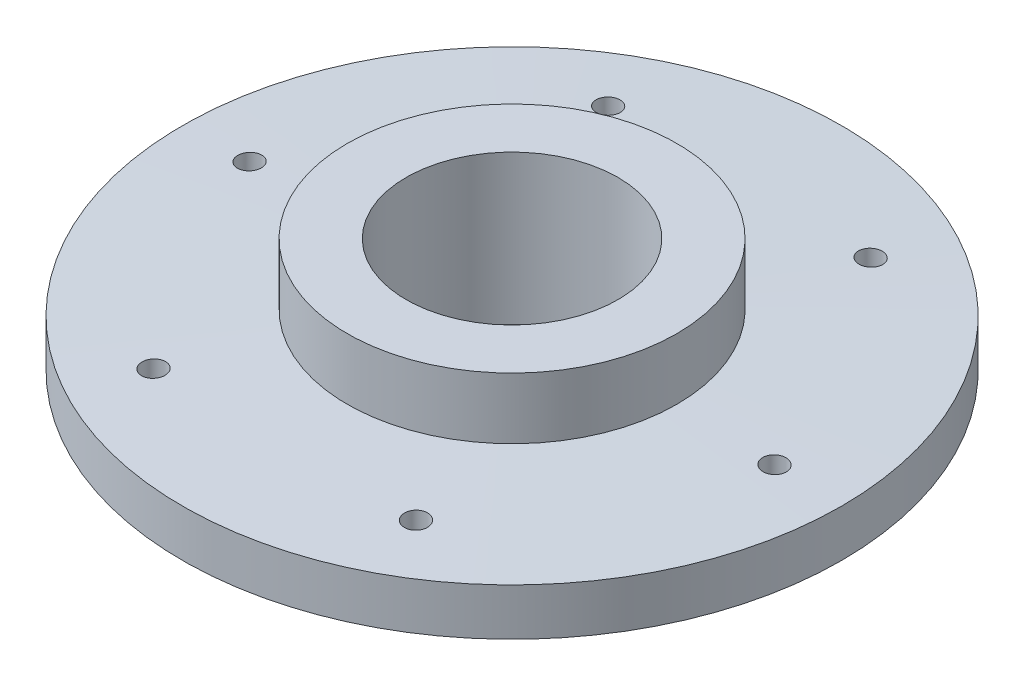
SolidWorks part; units mm, degrees
ref_plane "Plan de face" through (0, 0, 0) normal (0, 0, 1) x (1, 0, 0)
ref_plane "Plan de dessus" through (0, 0, 0) normal (0, 1, 0) x (1, 0, 0)
ref_plane "Plan de droite" through (0, 0, 0) normal (1, 0, 0) x (0, 0, -1)
sketch "Esquisse1" plane through (0, 0, 0) normal (0, 0, 1) x (1, 0, 0)
  line L0 (7, 6.3444) -> (0, 6.3444)
  line L1 (0, 6.3444) -> (0, 0)
  line L2 (0, 0) -> (8, 0)
  line L3 (8, 0) -> (14, 1.5)
  line L4 (14, 1.5) -> (14, 3.5)
  line L5 (14, 3.5) -> (7, 3.7444)
  line L6 (7, 3.7444) -> (7, 6.3444)
  line L7 (0, 6.3444) -> (0, 0) construction
revolve "Révolution1" add sketch "Esquisse1" angle 360 about L7
ref_plane "Plan4" through (0, 0, 0) normal (0.866, 0, 0.5) x (0, 1, 0)
sketch "Esquisse2" plane through (0, 0, 0) normal (0.866, 0, 0.5) x (0, 1, 0)
  line L0 (3.617, 11.15) -> (3.617, 11.65)
  line L1 (3.617, 11.65) -> (0.6625, 11.65)
  line L2 (0.6625, 11.65) -> (0.6625, 11.15)
  line L3 (0.6625, 11.15) -> (3.617, 11.15)
  line L4 (0.6625, 11.15) -> (3.617, 11.15) construction
revolve "Enlèvement de matière-Révolution1" cut sketch "Esquisse2" angle 360 about L4
sketch "Esquisse3" plane through (0, 0, 0) normal (0, 0, 1) x (1, 0, 0)
  line L0 (-10.65, 3.617) -> (-11.15, 3.617)
  line L1 (-11.15, 3.617) -> (-11.15, 0.6625)
  line L2 (-11.15, 0.6625) -> (-10.65, 0.6625)
  line L3 (-10.65, 0.6625) -> (-10.65, 3.617)
  line L4 (-11.15, 3.617) -> (-11.15, 0.6625) construction
revolve "Enlèvement de matière-Révolution2" cut sketch "Esquisse3" angle 360 about L4
sketch "Esquisse4" plane through (0, 0, 0) normal (0.866, 0, 0.5) x (0, 1, 0)
  line L0 (3.617, -11.65) -> (3.617, -11.15)
  line L1 (3.617, -11.15) -> (0.6625, -11.15)
  line L2 (0.6625, -11.15) -> (0.6625, -11.65)
  line L3 (0.6625, -11.65) -> (3.617, -11.65)
  line L4 (3.617, -11.15) -> (0.6625, -11.15) construction
revolve "Enlèvement de matière-Révolution3" cut sketch "Esquisse4" angle 360 about L4
sketch "Esquisse5" plane through (0, 0, 0) normal (0, 0, 1) x (1, 0, 0)
  line L0 (11.65, 3.617) -> (11.15, 3.617)
  line L1 (11.15, 3.617) -> (11.15, 0.6625)
  line L2 (11.15, 0.6625) -> (11.65, 0.6625)
  line L3 (11.65, 0.6625) -> (11.65, 3.617)
  line L4 (11.15, 3.617) -> (11.15, 0.6625) construction
revolve "Enlèvement de matière-Révolution4" cut sketch "Esquisse5" angle 360 about L4
ref_plane "Plan5" through (0, 0, 0) normal (0.866, 0, -0.5) x (0, 1, 0)
sketch "Esquisse6" plane through (0, 0, 0) normal (0.866, 0, -0.5) x (0, 1, 0)
  line L0 (3.617, 11.15) -> (3.617, 11.65)
  line L1 (3.617, 11.65) -> (0.6625, 11.65)
  line L2 (0.6625, 11.65) -> (0.6625, 11.15)
  line L3 (0.6625, 11.15) -> (3.617, 11.15)
  line L4 (0.6625, 11.15) -> (3.617, 11.15) construction
revolve "Enlèvement de matière-Révolution5" cut sketch "Esquisse6" angle 360 about L4
sketch "Esquisse7" plane through (0, 0, 0) normal (0.866, 0, -0.5) x (0, 1, 0)
  line L0 (3.617, -11.65) -> (3.617, -11.15)
  line L1 (3.617, -11.15) -> (0.6625, -11.15)
  line L2 (0.6625, -11.15) -> (0.6625, -11.65)
  line L3 (0.6625, -11.65) -> (3.617, -11.65)
  line L4 (3.617, -11.15) -> (0.6625, -11.15) construction
revolve "Enlèvement de matière-Révolution6" cut sketch "Esquisse7" angle 360 about L4
hole_wizard "Diamètre du perçage Ø9.0 (9)1" positions "Esquisse9" profile "Esquisse8" hole size "Ø9.0" standard "ISO"
sketch "Esquisse9" plane through (0, 0, 0) normal (0, -1, 0) x (1, 0, 0)
  point P0 (0, 0)
sketch "Esquisse8" plane through (0, 0, 0) normal (1, 0, 0) x (0, 0, -1)
  line L0 (0, 0) -> (0, 6.3444)
  line L1 (0, 6.3444) -> (4.5, 6.3444)
  line L2 (4.5, 6.3444) -> (4.5, 0)
  line L5 (4.5, 0) -> (0, 0)
  line L11 (0, -6.35) -> (0, 107.95) construction
  dimension "Diamètre du perçage jusqu'au prochain" = 9
  dimension "Profondeur du perçage jusqu'au prochain" = 6.3444
